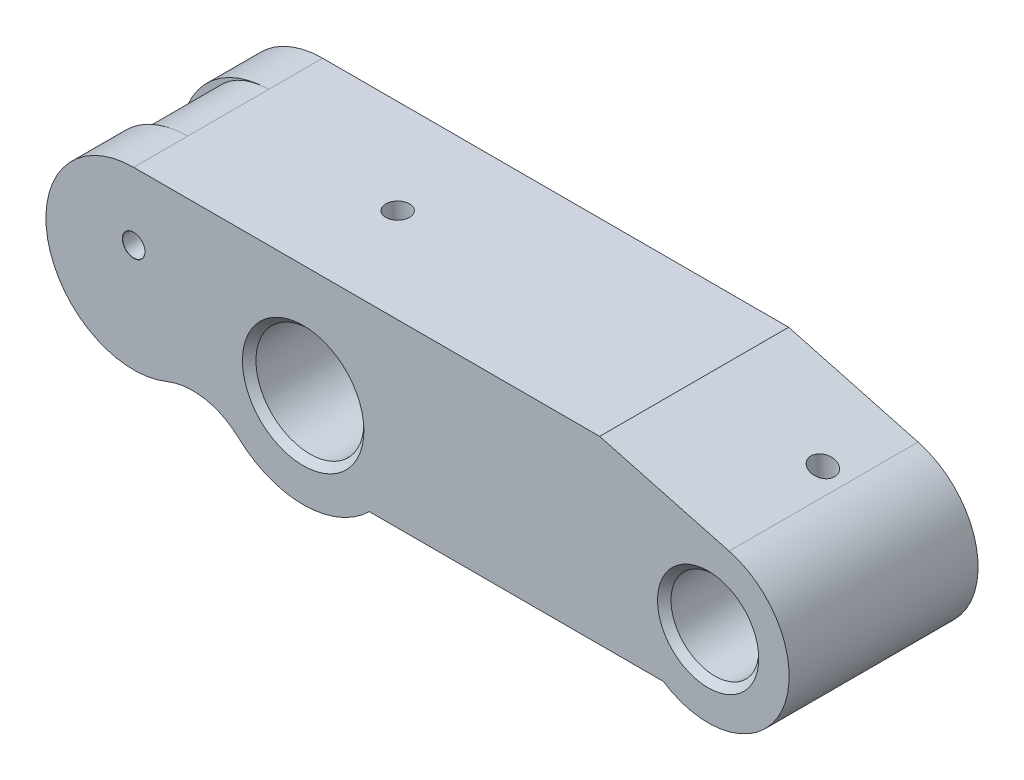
SolidWorks part; units mm, degrees
ref_plane "前视基准面" through (0, 0, 0) normal (0, 0, 1) x (1, 0, 0)
ref_plane "上视基准面" through (0, 0, 0) normal (0, 1, 0) x (1, 0, 0)
ref_plane "右视基准面" through (0, 0, 0) normal (1, 0, 0) x (0, 0, -1)
other "Configuration Table"
sketch "草图1" plane through (0, 0, 0) normal (0, 0, 1) x (1, 0, 0)
  line L0 (-25.1141, 6.7293) -> (0, 0) construction
  line L1 (0, 0) -> (60, 0) construction
  line L2 (9.798, -10) -> (53.3668, -10)
  line L3 (-25.1141, 16.7293) -> (43.9299, 16.7293)
  line L4 (43.9299, 16.7293) -> (63.1058, 11.5911)
  circle A0 centre (0, 0) radius 8
  arc A1 (53.3668, -10) -> (63.1058, 11.5911) centre (60, 0) ccw
  circle A2 centre (-25.1141, 6.7293) radius 1.5
  arc A3 (-25.1141, 16.7293) -> (-22.7396, -2.9847) centre (-25.1141, 6.7293) ccw
  arc A4 (-11.8797, -7.4076) -> (-22.7396, -2.9847) centre (-20.3652, -12.6987) ccw
  arc A5 (-11.8797, -7.4076) -> (9.798, -10) centre (0, 0) ccw
  circle A6 centre (60, 0) radius 6.5
  dimension "D1" = 16
  dimension "D2" = 24
  dimension "D4" = 3
  dimension "D7" = 20
  dimension "D8" = 20
  dimension "D9" = 14
  dimension "D10" = 10
  dimension "D11" = 13
  dimension "D3" = 60
  dimension "D5" = 15
  dimension "D6" = 26
  dimension "D12" = 15
extrude "凸台-拉伸1" add sketch "草图1" along normal mid plane 28
sketch "草图6" plane through (0, 0, 14) normal (0, 0, 1) x (1, 0, 0)
  line L0 (43.9299, 16.7293) -> (-25.1141, 16.7293) construction
  arc A2 (-25.1141, 16.7293) -> (-20.1747, -8.2958) centre (-25.1141, 3.7293) ccw
  arc A3 (-25.1141, 16.7293) -> (-22.7396, -2.9847) centre (-25.1141, 6.7293) ccw construction
  arc A4 (-16.8441, -7.5568) -> (-20.1747, -8.2958) centre (-16.3751, -17.5458) ccw
  arc A5 (-11.8797, -7.4076) -> (9.798, -10) centre (0, 0) ccw construction
  arc A6 (-8.9983, -10.7943) -> (-20.1747, -8.2958) centre (-16.3751, -17.5458) ccw
  dimension "D1" = 26
  dimension "D2" = 20
chamfer "倒角1" distance 1 angle 45 4 edges at (66.5, 0, 14) (66.5, 0, -14) (8, 0, -14) (8, 0, 14)
extrude "凸台-拉伸3" add sketch "草图6" against normal blind 8 contours A6 A4 M3 M9 M8
mirror "镜向3" about plane through (0, 0, 0) normal (0, 0, 1) of "凸台-拉伸3"
hole_wizard "M4 螺纹孔的螺纹孔钻头1" positions "草图7" profile "草图8" hole size "M4" standard "GB"
sketch "草图7" plane through (0, 0, 14) normal (0, 0, 1) x (1, 0, 0)
  point P0 (-25.1141, 6.7293)
sketch "草图8" plane through (-25.1141, 6.7293, 14) normal (1, 0, 0) x (0, -1, 0)
  line L0 (0, 0) -> (0, 8.9914)
  line L1 (0, 8.9914) -> (1.65, 8)
  line L2 (1.65, 8) -> (1.65, 0.025)
  line L3 (1.65, 0.025) -> (1.675, 0)
  line L5 (1.675, 0) -> (0, 0)
  line L6 (-1.65, 0.025) -> (-1.675, 0) construction
  line L10 (0, 8.9914) -> (-1.65, 8) construction
  line L11 (0, -6.35) -> (0, 107.95) construction
  dimension "孔直径" = 3.3
  dimension "孔深度" = 8
  dimension "近端锥形沉头孔直径" = 3.35
  dimension "近端锥形沉头孔角度" = 90
  dimension "导头角度" = 118
mirror "镜向4" about plane through (0, 0, 0) normal (0, 0, 1) of "M4 螺纹孔的螺纹孔钻头1"
sketch "草图10" plane through (0, 16.7293, 0) normal (0, 1, 0) x (1, 0, 0)
  circle A0 centre (0, 0) radius 1.75
  dimension "D1" = 3.5
extrude "切除-拉伸2" cut sketch "草图10" against normal blind 15
sketch "草图12" plane through (0, 16.7293, 0) normal (0, 1, 0) x (1, 0, 0)
  line L0 (63.1058, 14) -> (43.9299, 14) construction
  circle A0 centre (60, 3) radius 1.75
  dimension "D1" = 3.5
  dimension "D2" = 60
  dimension "D3" = 11
extrude "切除-拉伸3" cut sketch "草图12" against normal blind 11
